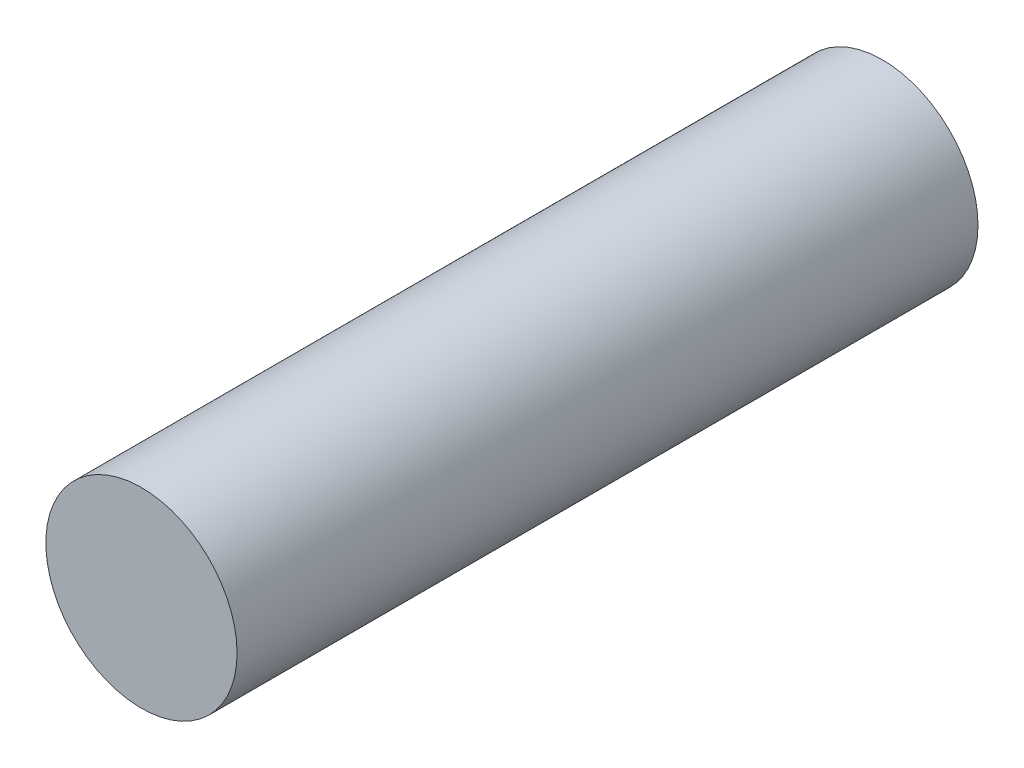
SolidWorks part; units mm, degrees
ref_plane "Ebene1" through (0, 0, 0) normal (0, 0, 1) x (1, 0, 0)
ref_plane "Ebene2" through (0, 0, 0) normal (0, 1, 0) x (1, 0, 0)
ref_plane "Ebene3" through (0, 0, 0) normal (1, 0, 0) x (0, 0, -1)
sketch "Skizze1" plane through (0, 0, 0) normal (0, 0, 1) x (1, 0, 0)
  circle A0 centre (0, 0) radius 64.5247
extrude "Linear austragen1" add sketch "Skizze1" along normal mid plane 500
